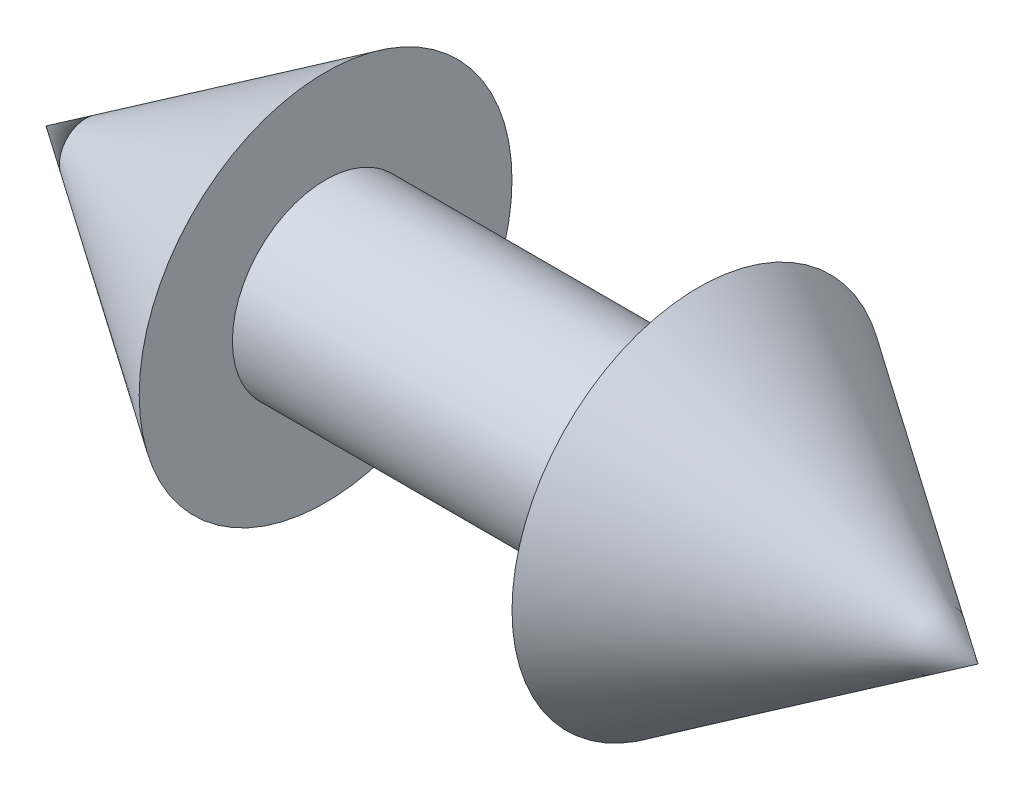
SolidWorks part; units mm, degrees
ref_plane "Plan de face" through (0, 0, 0) normal (0, 0, 1) x (1, 0, 0)
ref_plane "Plan de dessus" through (0, 0, 0) normal (0, 1, 0) x (1, 0, 0)
ref_plane "Plan de droite" through (0, 0, 0) normal (1, 0, 0) x (0, 0, -1)
sketch "Esquisse1" plane through (0, 0, 0) normal (0, 0, 1) x (1, 0, 0)
  line L0 (-1000, 0) -> (49000, 0) construction
  line L1 (0, -1000) -> (0, 49000) construction
  line L2 (-0.5, 0.25) -> (0.5, 0.25)
  line L3 (0.5, 0.25) -> (0.5, 0.5)
  line L4 (0.5, 0.5) -> (1.25, 0)
  line L5 (1.25, 0) -> (-1.25, 0)
  line L6 (-0.5, 0.5) -> (-1.25, 0)
  line L7 (-0.5, 0.25) -> (-0.5, 0.5)
  point P4 (0, 0)
  point P10 (0, 0)
  point P13 (0, 0.25)
revolve "Révolution1" add sketch "Esquisse1" angle 360 about L0
